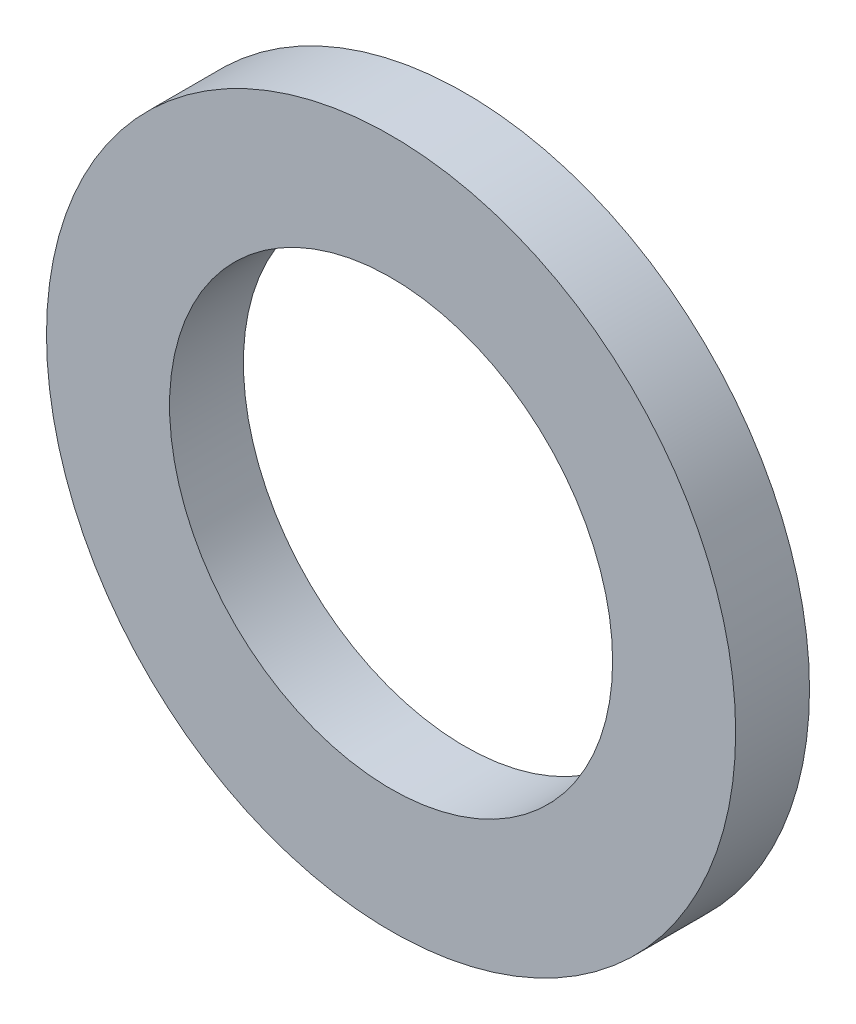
SolidWorks part; units mm, degrees
ref_plane "Plan de face" through (0, 0, 0) normal (0, 0, 1) x (1, 0, 0)
ref_plane "Plan de dessus" through (0, 0, 0) normal (0, 1, 0) x (1, 0, 0)
ref_plane "Plan de droite" through (0, 0, 0) normal (1, 0, 0) x (0, 0, -1)
sketch "Esquisse1" plane through (0, 0, 0) normal (0, 1, 0) x (1, 0, 0)
  line L0 (4.5, -1.5) -> (7, -1.5)
  line L1 (7, -1.5) -> (7, 0)
  line L2 (7, 0) -> (4.5, 0)
  line L3 (4.5, 0) -> (4.5, -1.5)
  line L4 (0, 0) -> (0, -1.5) construction
  dimension "D1" = 1.5
  dimension "D2" = 4.5
  dimension "D3" = 7
revolve "Révolution1" add sketch "Esquisse1" angle 360 about L4
